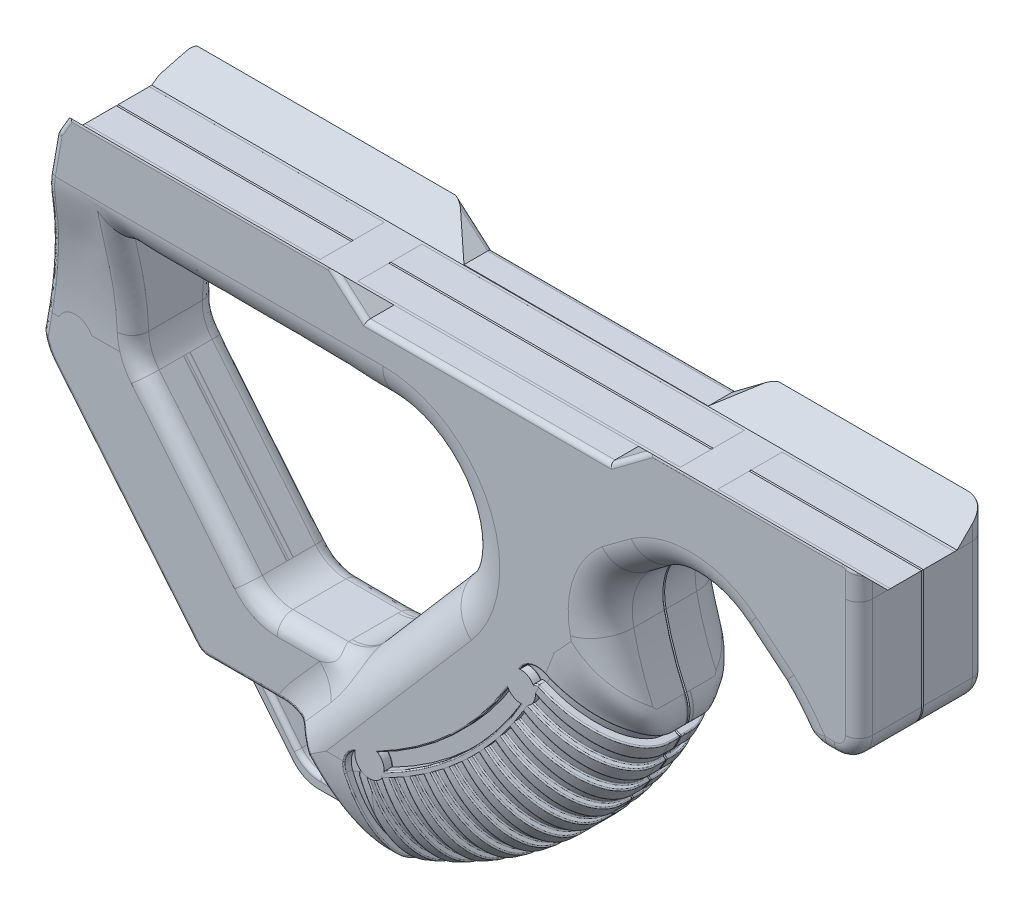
SolidWorks part; units mm, degrees
ref_plane "Front Plane" through (0, 0, 0) normal (0, 0, 1) x (1, 0, 0)
ref_plane "Top Plane" through (0, 0, 0) normal (0, 1, 0) x (1, 0, 0)
ref_plane "Right Plane" through (0, 0, 0) normal (1, 0, 0) x (0, 0, -1)
imported_body "hera_cqr_.step"
sketch "Sketch2" plane through (0, 0, 14.1003) normal (0, 0, 1) x (1, 0, 0)
  line L0 (57.6848, 36.3531) -> (57.1811, 36.7692) construction
  line L1 (57.6848, 36.3531) -> (57.1811, 36.7692)
  line L2 (-44.9575, 49.8193) -> (-49.7496, 49.8222) construction
  line L3 (-42.559, 53.9678) -> (-44.9575, 49.8193) construction
  line L4 (-44.9525, 58.1193) -> (-42.559, 53.9678) construction
  line L5 (-49.7445, 58.1222) -> (-44.9525, 58.1193) construction
  line L6 (-52.143, 53.9736) -> (-49.7445, 58.1222) construction
  line L7 (-49.7496, 49.8222) -> (-52.143, 53.9736) construction
  line L8 (35.0449, 49.7912) -> (30.2529, 49.7945) construction
  line L9 (30.2529, 49.7945) -> (27.8598, 53.9462) construction
  line L10 (27.8598, 53.9462) -> (30.2587, 58.0945) construction
  line L11 (37.4438, 53.9395) -> (35.0449, 49.7912) construction
  line L12 (35.0507, 58.0912) -> (37.4438, 53.9395) construction
  line L13 (30.2587, 58.0945) -> (35.0507, 58.0912) construction
  line L14 (-44.9575, 49.8193) -> (-46.437, 49.8201)
  line L15 (-42.559, 53.9678) -> (-43.2996, 52.687)
  line L16 (-44.9525, 58.1193) -> (-44.2136, 56.8375)
  line L17 (-49.7445, 58.1222) -> (-48.265, 58.1213)
  line L18 (-52.143, 53.9736) -> (-51.4025, 55.2544)
  line L19 (-49.7496, 49.8222) -> (-50.4885, 51.1039)
  line L20 (35.0449, 49.7912) -> (33.5654, 49.7922)
  line L21 (30.2529, 49.7945) -> (29.514, 51.0763)
  line L22 (27.8598, 53.9462) -> (28.6004, 55.227)
  line L23 (37.4438, 53.9395) -> (36.7032, 52.6588)
  line L24 (35.0507, 58.0912) -> (35.7895, 56.8094)
  line L25 (30.2587, 58.0945) -> (31.7382, 58.0935)
  line L26 (35.7855, 51.072) -> (35.0449, 49.7912)
  line L27 (36.7049, 55.2213) -> (37.4438, 53.9395)
  line L28 (33.5712, 58.0922) -> (35.0507, 58.0912)
  line L29 (29.518, 56.8138) -> (30.2587, 58.0945)
  line L30 (28.5986, 52.6644) -> (27.8598, 53.9462)
  line L31 (31.7324, 49.7935) -> (30.2529, 49.7945)
  line L32 (-43.298, 55.2495) -> (-42.559, 53.9678)
  line L33 (-44.217, 51.1001) -> (-44.9575, 49.8193)
  line L34 (-48.2701, 49.8213) -> (-49.7496, 49.8222)
  line L35 (-51.4041, 52.6919) -> (-52.143, 53.9736)
  line L36 (-46.432, 58.1201) -> (-44.9525, 58.1193)
  line L37 (-50.4851, 56.8413) -> (-49.7445, 58.1222)
  arc A0 (57.6848, 36.3531) -> (57.1811, 36.7692) centre (60.7306, 40.5523) ccw construction
  arc A1 (-32.0745, -28.4108) -> (-36.7701, -30.5507) centre (-33.6028, -31.2791) ccw construction
  arc A2 (-0.4995, 3.2114) -> (-2.9703, -1.3191) centre (0, 0) ccw construction
  circle A3 centre (-47.351, 53.9707) radius 4.25 construction
  circle A4 centre (32.6518, 53.9429) radius 4.25 construction
  arc A5 (57.6848, 36.3531) -> (57.1811, 36.7692) centre (60.7306, 40.5523) ccw
  arc A6 (-32.0745, -28.4108) -> (-36.7701, -30.5507) centre (-33.6028, -31.2791) ccw
  arc A7 (-0.4995, 3.2114) -> (-2.9703, -1.3191) centre (0, 0) ccw
  arc A8 (-43.298, 55.2495) -> (-44.2136, 56.8375) centre (-47.351, 53.9707) ccw
  arc A9 (35.7855, 51.072) -> (35.7895, 56.8094) centre (32.6518, 53.9429) ccw
  circle A10 centre (0, 0) radius 3.25
  circle A11 centre (-33.6028, -31.2791) radius 3.25
  arc A12 (33.5712, 58.0922) -> (31.7382, 58.0935) centre (32.6518, 53.9429) ccw
  arc A13 (29.518, 56.8138) -> (28.6004, 55.227) centre (32.6518, 53.9429) ccw
  arc A14 (28.5986, 52.6644) -> (29.514, 51.0763) centre (32.6518, 53.9429) ccw
  arc A15 (31.7324, 49.7935) -> (33.5654, 49.7922) centre (32.6518, 53.9429) ccw
  arc A16 (-44.217, 51.1001) -> (-43.2996, 52.687) centre (-47.351, 53.9707) ccw
  arc A17 (-48.2701, 49.8213) -> (-46.437, 49.8201) centre (-47.351, 53.9707) ccw
  arc A18 (-51.4041, 52.6919) -> (-50.4885, 51.1039) centre (-47.351, 53.9707) ccw
  arc A19 (-46.432, 58.1201) -> (-48.265, 58.1213) centre (-47.351, 53.9707) ccw
  arc A20 (-50.4851, 56.8413) -> (-51.4025, 55.2544) centre (-47.351, 53.9707) ccw
extrude "Boss-Extrude1" add sketch "Sketch2" against normal up to surface (28.2006 mm away) contours M37 | L1 A5 | M36 | A10 M20 | A11 M18 | L23 L20 M37 | L21 L20 M37 | L22 L21 M37 | L25 L22 M37 | L25 L24 M37 | L24 L23 M37 | L17 L16 M36 | L18 L17 M36 | L19 L18 M36 | L19 L14 M36 | L15 L14 M36 | L16 L15 M36
sketch "Sketch3" plane through (75.1408, -0.0003, 0) normal (1, 0, 0) x (0, 0, -1)
  line L1 (15.6003, 35.365) -> (15.6003, 45.7401) construction
  line L2 (-15.6003, 44.5525) -> (-15.6003, 36.5525) construction
  line L3 (15.6003, 32.8182) -> (15.6003, 48.1915)
  line L4 (-15.6003, 47.3983) -> (-15.6003, 32.4428)
  line L5 (-0.2, 52.9126) -> (-7.1165, 52.9126)
  line L6 (-7.1165, 52.9126) -> (-11.1003, 52.9126)
  line L7 (-11.1003, 52.9126) -> (-11.1003, 26.671)
  line L8 (-11.1003, 26.671) -> (-0.2, 26.671)
  line L9 (-0.2, 26.671) -> (-0.2, 52.9126)
  line L10 (-0.2, 52.9126) -> (-7.1165, 52.9126)
  line L11 (-7.1165, 52.9126) -> (-11.1003, 52.9126)
  line L12 (-11.1003, 52.9126) -> (-11.1003, 26.671)
  line L13 (-11.1003, 26.671) -> (-0.2, 26.671)
  line L14 (-0.2, 26.671) -> (-0.2, 52.9126)
  line L15 (14.1003, 52.9126) -> (14.1003, 26.671) construction
  line L16 (-14.1003, 52.9126) -> (-14.1003, 26.671) construction
  line L17 (14.1003, 52.9126) -> (14.1003, 26.671)
  line L18 (-14.1003, 52.9126) -> (-14.1003, 26.671)
  line L19 (-15.6003, 47.3983) -> (-14.1003, 47.3983)
  line L21 (-14.1003, 32.4428) -> (-15.6003, 32.4428)
  line L22 (-15.6003, 32.4428) -> (-14.1003, 32.4428)
  line L23 (15.6003, 48.1915) -> (14.1003, 48.1915)
  line L25 (15.6003, 32.8182) -> (14.1003, 32.8182)
  dimension "D1" = 0
extrude "Cut-Extrude2" cut sketch "Sketch3" against normal blind 31 contours L21 L18 L19 L4 | L25 L3 L23 L17
ref_plane "Plane1" through (-0.0001, 0.0008, -9.3781) normal (0, -0.0001, 1) x (1, 0, 0)
ref_plane "Plane2" through (0, 0, 0.6219) normal (0, -0.0001, 1) x (1, 0, 0)
sketch "Sketch5" plane through (0, 0, 0.6219) normal (0, -0.0001, 1) x (1, 0, 0)
  spline S0 degree 3 poles (-70.1933, -31.5377) (-68.596, -31.4233) (-67.1641, -30.7063) (-66.1156, -29.4959) (-65.6101, -27.9764) (-65.7246, -26.3792) (-66.4416, -24.9473) (-67.652, -23.8988) (-69.1714, -23.3933) (-70.7687, -23.5078) (-72.2006, -24.2248) (-73.2491, -25.4352) (-73.7546, -26.9546) (-73.6401, -28.5519) (-72.9231, -29.9838) (-71.7127, -31.0323) (-70.1933, -31.5377) (-68.596, -31.4233) (-67.1641, -30.7063) knots -0.1875 -0.125 -0.0625 0 0.0625 0.125 0.1875 0.25 0.3125 0.375 0.4375 0.5 0.5625 0.625 0.6875 0.75 0.8125 0.875 0.9375 1 1.0625 1.125 1.1875 only from (-68.6236, -31.3229) to (-68.6236, -31.3229) construction
  spline S1 degree 3 poles (512.8655, -1893.2876) (-125.1327, 30.0844) (-109.2738, 6.8863) (-102.0687, 9.7571) (-101.8078, 9.8822) (-101.5565, 10.0268) (-101.3147, 10.1909) (-100.9325, 10.4929) (-100.4604, 10.9899) (-100.012, 11.7447) (-99.7323, 12.5762) (-99.655, 13.3544) (-99.708, 14.0311) (-101.851, 23.757) (-146.8575, 18.5815) (1782.4291, 690.1076) knots -3.20665 -3.20665 -3.20665 -3.20665 0.041816 0.083328 0.124706 0.166153 0.207913 0.250262 0.375546 0.500069 0.624981 0.749894 0.833477 0.916252 5.009275 5.009275 5.009275 5.009275 only from (-102.6175, 9.5669) to (-100.0623, 15.1385) construction
  spline S2 degree 3 poles (-1972.1192, 737.6482) (-67.4068, 18.6053) (-105.1518, 23.1002) (-107.5944, 14.2823) (-107.6671, 13.8351) (-107.6861, 13.3767) (-107.6359, 12.689) (-107.3945, 11.7928) (-106.7788, 10.8193) (-105.9287, 10.0439) (-104.9966, 9.6099) (-104.1298, 9.4235) (-93.1167, 9.1114) (-89.1105, 63.9702) (170.4306, -1971.5126) knots -2.854341 -2.854341 -2.854341 -2.854341 0.050225 0.099719 0.149154 0.199176 0.250408 0.375947 0.500087 0.624881 0.749798 0.833555 0.915824 4.342665 4.342665 4.342665 4.342665 only from (-107.2906, 15.1379) to (-102.6175, 9.5669) construction
  spline S3 degree 3 poles (-1859.7588, 978.7603) (-89.9961, -8.2306) (-110.4377, 10.2998) (-107.0607, 15.5426) (-106.882, 15.803) (-106.383, 16.4111) (-105.3294, 17.1618) (-103.8634, 17.468) (-102.5521, 17.2933) (-101.6539, 16.8849) (-100.9979, 16.3904) (-100.6035, 15.9759) (-94.8774, 8.2669) (-121.8005, -19.6644) (1608.6449, 1054.3695) knots -2.011595 -2.011595 -2.011595 -2.011595 0.026053 0.052001 0.078208 0.132033 0.315519 0.499011 0.620344 0.754343 0.824702 0.89504 0.94554 4.038776 4.038776 4.038776 4.038776 only from (-107.2906, 15.1379) to (-100.0623, 15.1385) construction
  spline S4 degree 3 poles (-70.1933, -31.5377) (-68.596, -31.4233) (-67.1641, -30.7063) (-66.1156, -29.4959) (-65.6101, -27.9764) (-65.7246, -26.3792) (-66.4416, -24.9473) (-67.652, -23.8988) (-69.1714, -23.3933) (-70.7687, -23.5078) (-72.2006, -24.2248) (-73.2491, -25.4352) (-73.7546, -26.9546) (-73.6401, -28.5519) (-72.9231, -29.9838) (-71.7127, -31.0323) (-70.1933, -31.5377) (-68.596, -31.4233) (-67.1641, -30.7063) knots -0.1875 -0.125 -0.0625 0 0.0625 0.125 0.1875 0.25 0.3125 0.375 0.4375 0.5 0.5625 0.625 0.6875 0.75 0.8125 0.875 0.9375 1 1.0625 1.125 1.1875 only from (-68.6236, -31.3229) to (-68.6236, -31.3229)
  spline S5 degree 3 poles (-102.6175, 9.5669) (-102.5242, 9.5945) (-102.3384, 9.6496) (-102.0687, 9.7571) (-101.8078, 9.8822) (-101.5565, 10.0268) (-101.3147, 10.1909) (-100.9325, 10.4929) (-100.4604, 10.9899) (-100.012, 11.7447) (-99.7323, 12.5762) (-99.655, 13.3544) (-99.708, 14.0311) (-99.8338, 14.6022) (-99.9858, 14.9591) (-100.0623, 15.1385) knots 0 0 0 0 0.041816 0.083328 0.124706 0.166153 0.207913 0.250262 0.375546 0.500069 0.624981 0.749894 0.833477 0.916252 1 1 1 1
  spline S6 degree 3 poles (-107.2906, 15.1379) (-107.3517, 14.998) (-107.4731, 14.7202) (-107.5944, 14.2823) (-107.6671, 13.8351) (-107.6861, 13.3767) (-107.6359, 12.689) (-107.3945, 11.7928) (-106.7788, 10.8193) (-105.9287, 10.0439) (-104.9966, 9.6099) (-104.1298, 9.4235) (-103.3628, 9.4018) (-102.8678, 9.5114) (-102.6175, 9.5669) knots 0 0 0 0 0.050225 0.099719 0.149154 0.199176 0.250408 0.375947 0.500087 0.624881 0.749798 0.833555 0.915824 1 1 1 1
  spline S7 degree 3 poles (-107.2906, 15.1379) (-107.256, 15.2075) (-107.1871, 15.3464) (-107.0607, 15.5426) (-106.882, 15.803) (-106.383, 16.4111) (-105.3294, 17.1618) (-103.8634, 17.468) (-102.5521, 17.2933) (-101.6539, 16.8849) (-100.9979, 16.3904) (-100.6035, 15.9759) (-100.2912, 15.5554) (-100.1405, 15.2809) (-100.0623, 15.1385) knots 0 0 0 0 0.026053 0.052001 0.078208 0.132033 0.315519 0.499011 0.620344 0.754343 0.824702 0.89504 0.94554 1 1 1 1
extrude "Boss-Extrude3" add sketch "Sketch5" against normal up to surface and the other way up to surface
sketch "Sketch1" plane through (75.1408, -0.0003, 0) normal (1, 0, 0) x (0, 0, -1)
  line L1 (18.575, 63.7935) -> (18.575, 79.1816)
  line L2 (18.575, 79.1816) -> (7.694, 90.0626)
  line L3 (7.694, 90.0626) -> (-7.694, 90.0626)
  line L4 (-7.694, 90.0626) -> (-18.575, 79.1816)
  line L5 (-18.575, 79.1816) -> (-18.575, 63.7935)
  line L6 (-18.575, 63.7935) -> (-7.694, 52.9126)
  line L7 (-7.694, 52.9126) -> (7.694, 52.9126)
  line L8 (7.694, 52.9126) -> (18.575, 63.7935)
  line L9 (7.1165, 52.9126) -> (0.2, 52.9126) construction
  circle A0 centre (0, 71.4876) radius 18.575 construction
  dimension "D1" = 37.15
extrude "Cut-Extrude1" cut sketch "Sketch1" against normal through all
ref_plane "Plane3" through (0, 0, 0) normal (0, 0, 1) x (1, 0, 0)
sketch "Sketch7" plane through (0, 0, 0) normal (0, 0, 1) x (1, 0, 0)
  line L0 (-110.8588, 12.112) -> (-103.4623, 54.6236)
  line L1 (-103.4623, 54.6236) -> (-110.8588, 54.6236)
  line L3 (-110.8588, 12.112) -> (-114.5793, 12.112)
  line L4 (-114.5793, 12.112) -> (-114.5793, 54.6236)
  line L5 (-114.5793, 54.6236) -> (-110.8588, 54.6236)
  arc A0 (-109.97, 49.6331) -> (-104.0082, 53.5008) centre (-110.8528, 57.5227) ccw construction
extrude "Cut-Extrude3" cut sketch "Sketch7" against normal through all both and the other way through all
fillet "Fillet1" radius 1.5 11 edges at (-103.5102, 54.3483, -11.0674) (-103.5572, 54.0778, -13.4547) (-103.5102, 54.3483, 11.0674) (-103.5572, 54.0778, 13.4547) (-107.8371, 29.4794, -10.6473) (-110.8273, 12.2932, 8.6243) (-107.8371, 29.4794, 10.6473)
